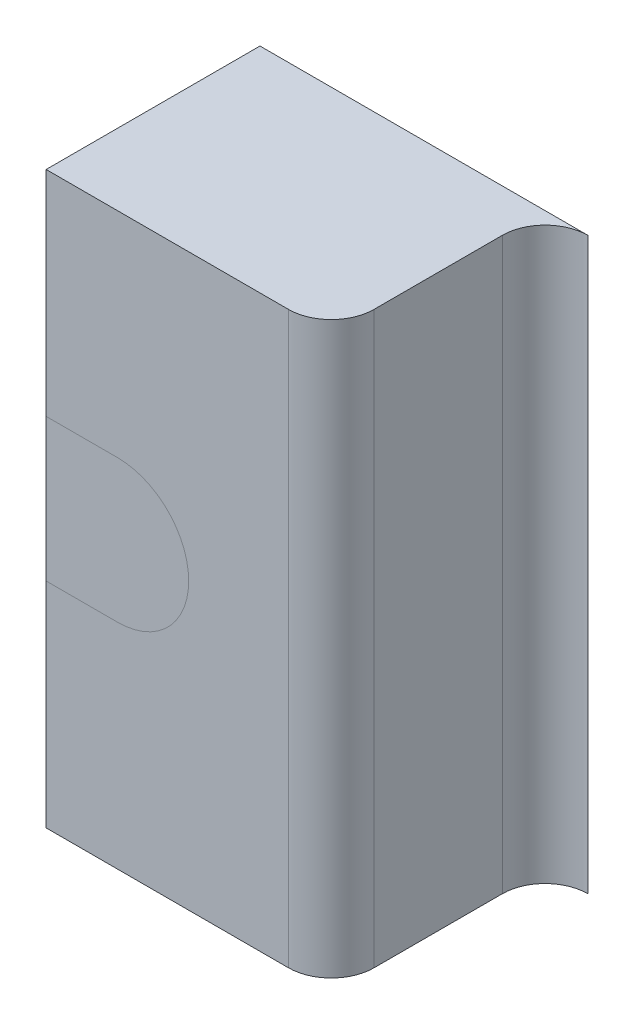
SolidWorks part; units mm, degrees
ref_plane "Płaszczyzna przednia" through (0, 0, 0) normal (0, 0, 1) x (1, 0, 0)
ref_plane "Płaszczyzna górna" through (0, 0, 0) normal (0, 1, 0) x (1, 0, 0)
ref_plane "Płaszczyzna prawa" through (0, 0, 0) normal (1, 0, 0) x (0, 0, -1)
sketch "Szkic1" plane through (0, 0, 0) normal (0, 0, 1) x (1, 0, 0)
  line L1 (0, 0) -> (50, 0)
  line L2 (0, 0) -> (0, 50)
  line L3 (0, 50) -> (50, 50)
  line L4 (50, 0) -> (50, 50)
  dimension "D1" = 50
  dimension "D2" = 50
extrude "Dodanie-wyciągnięcie1" add sketch "Szkic1" along normal blind 10
sketch "Szkic2" plane through (0, 0, 10) normal (0, 0, 1) x (1, 0, 0)
  line L0 (0, 50) -> (0, 0) construction
  line L1 (-18, 48.3859) -> (2, 48.3859)
  line L2 (-18, 48.3859) -> (-18, 8.3859)
  line L3 (-18, 8.3859) -> (2, 8.3859)
  line L4 (2, 48.3859) -> (2, 8.3859)
  point P4 (0, 48.3859)
  dimension "D1" = 20
  dimension "D2" = 40
  dimension "D3" = 2
extrude "Dodanie-wyciągnięcie2" add sketch "Szkic2" along normal blind 15
fillet "Zaokrąglenie1" radius 3 2 edges at (2, 28.3859, 10) (2, 28.3859, 25)
sketch "Szkic3" plane through (0, 0, 25) normal (0, 0, 1) x (1, 0, 0)
  line L0 (-18, 23.3859) -> (-18, 33.3859)
  line L1 (-18, 33.3859) -> (-13, 33.3859)
  line L2 (-13, 23.3859) -> (-18, 23.3859)
  line L4 (-18, 48.3859) -> (-18, 8.3859) construction
  arc A0 (-13, 33.3859) -> (-13, 23.3859) centre (-13, 28.3859) cw
  point P5 (-10.6349, 29.3636)
  point P6 (-8.9885, 29.3061)
  point P7 (-7.4948, 29.6847)
  point P10 (-18, 28.3859)
  point P11 (-18, 28.3859)
  dimension "D1" = 10
  dimension "D2" = 5
sketch "Szkic4" plane through (50, 0, 0) normal (1, 0, 0) x (0, 0, -1)
  line L4 (0, 0) -> (0, 50)
  line L5 (0, 50) -> (-10, 50)
  line L6 (-10, 50) -> (-10, 0)
  line L7 (-10, 0) -> (0, 0)
  line L8 (0, 0) -> (0, 50)
  line L9 (0, 50) -> (-10, 50)
  line L10 (-10, 50) -> (-10, 0)
  line L11 (-10, 0) -> (0, 0)
  dimension "D1" = 0
extrude "Wytnij-wyciągnięcie1" cut sketch "Szkic4" against normal through all
sketch "Szkic orientacji" plane through (0, 0, 10) normal (0, 0, -1) x (-1, 0, 0)
  line L0 (18, 48.3859) -> (18, 8.3859) construction
  line L1 (-5, 48.3859) -> (18, 48.3859) construction
  line L2 (-5, 48.3859) -> (-5, 8.3859) construction
  line L3 (18, 8.3859) -> (-5, 8.3859) construction
  line L4 (18, 48.3859) -> (18, 8.3859)
  line L5 (-5, 48.3859) -> (18, 48.3859)
  line L6 (-5, 48.3859) -> (-5, 8.3859)
  line L7 (18, 8.3859) -> (-5, 8.3859)
  point P3 (-2, 8.3859)
  point P5 (0, 0)
  point P6 (0, 8.3859)
  dimension "D1" = 3
other "Narzędzie formowania1"
